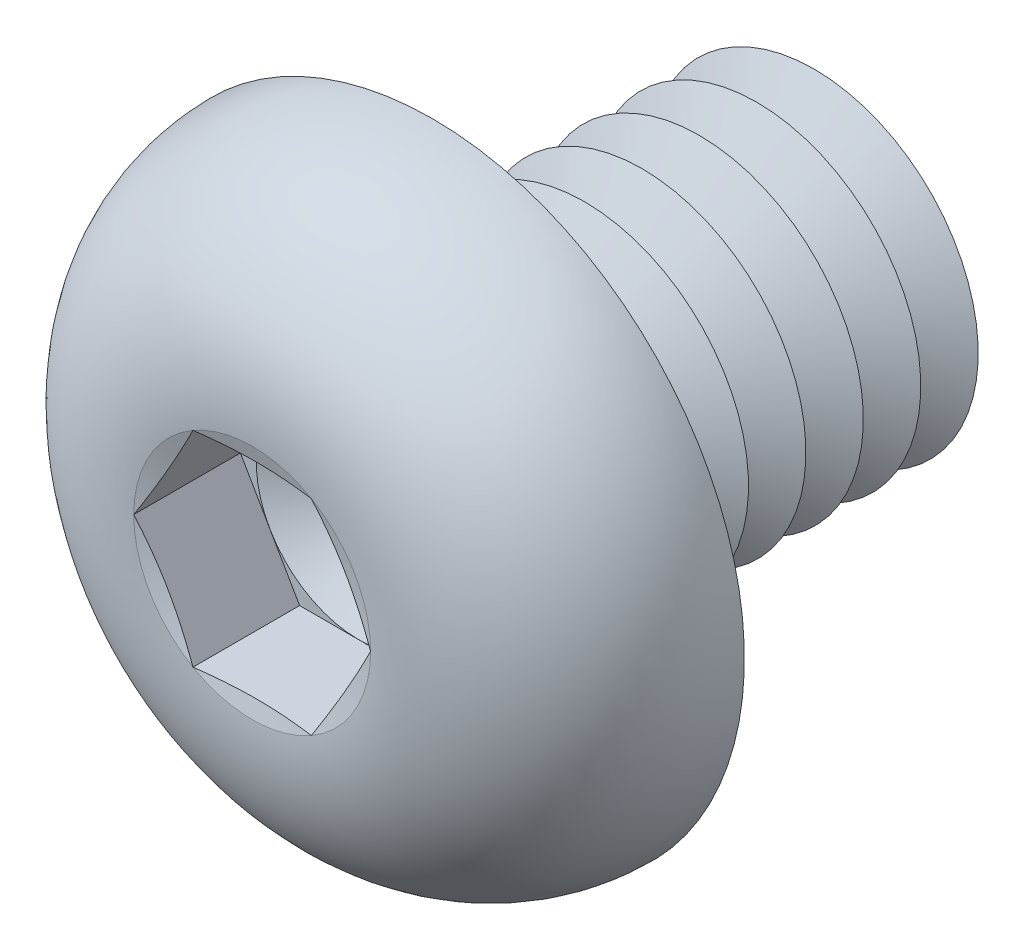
SolidWorks part; units mm, degrees
ref_plane "Front Plane" through (0, 0, 0) normal (0, 0, 1) x (1, 0, 0)
ref_plane "Top Plane" through (0, 0, 0) normal (0, 1, 0) x (1, 0, 0)
ref_plane "Right Plane" through (0, 0, 0) normal (1, 0, 0) x (0, 0, -1)
sketch "Sketch1" plane through (0, 0, 0) normal (1, 0, 0) x (0, 0, -1)
  line L0 (0, 2) -> (0, 3.8)
  line L3 (0, 2) -> (5, 2)
  line L4 (5, 2) -> (5, 0)
  line L5 (5, 0) -> (-2.2, 0) construction
  line L6 (-2.2, 0) -> (5, 0)
  line L7 (-2.2, 1.4434) -> (-2.2, 0.7217) construction
  line L8 (-2.2, 0.7217) -> (-2.2, 0)
  line L9 (-2.2, 1.4434) -> (-2.0066, 0.7217)
  line L10 (-2.0066, 0.7217) -> (-2.2, 0.7217)
  line L11 (5, 0) -> (22.7481, 0) construction
  line L12 (0, 3.8) -> (-2.2, 3.8) construction
  arc A1 (0, 3.8) -> (-2.2, 1.4434) centre (0, 1.5948) ccw
  point P8 (5, 1)
  dimension "D1" = 7.6
  dimension "D2" = 4
  dimension "D3" = 2.2
  dimension "D4" = 2.8868
  dimension "D5" = 5
  dimension "D6" = 15
revolve "Revolve1" add sketch "Sketch1" angle 360 about L5
fillet "Fillet1" radius 0.35 1 edges at (0, 2, 0)
sketch "Sketch2" plane through (0, 0, 0) normal (1, 0, 0) x (0, 0, -1)
  line L0 (4.65, 2) -> (5.35, 2)
  line L1 (5, 2) -> (0.35, 2) construction
  line L2 (5.35, 2) -> (5, 1.3938)
  line L3 (5, -2) -> (5, 2) construction
  line L4 (5, 1.3938) -> (4.65, 2)
  dimension "D1" = 0.7
revolve "Cut-Revolve1" cut sketch "Sketch2" angle 360 about axis through (0, 0, -5) along (0, 0, -1)
pattern_linear "LPattern1" count 7 spacing 0.7 along (0, 0, 1) of "Cut-Revolve1"
sketch "Sketch3" plane through (0, 0, 2.2) normal (0, 0, 1) x (1, 0, 0)
  line L7 (0.7217, 1.25) -> (-0.7217, 1.25)
  line L8 (-0.7217, 1.25) -> (-1.4434, 0)
  line L9 (-1.4434, 0) -> (-0.7217, -1.25)
  line L10 (-0.7217, -1.25) -> (0.7217, -1.25)
  line L11 (0.7217, -1.25) -> (1.4434, 0)
  line L12 (1.4434, 0) -> (0.7217, 1.25)
  circle A0 centre (0, 0) radius 1.25 construction
  circle A3 centre (0, 0) radius 1.4434 construction
extrude "Cut-Extrude1" cut sketch "Sketch3" against normal blind 1.3
sketch "Sketch4" plane through (0, 0, 0.9) normal (0, 0, 1) x (1, 0, 0)
  line L1 (0.7217, 1.25) -> (-0.7217, 1.25) construction
  circle A0 centre (0, 0) radius 1.25
extrude "Cut-Extrude2" cut sketch "Sketch4" against normal through all draft 60
